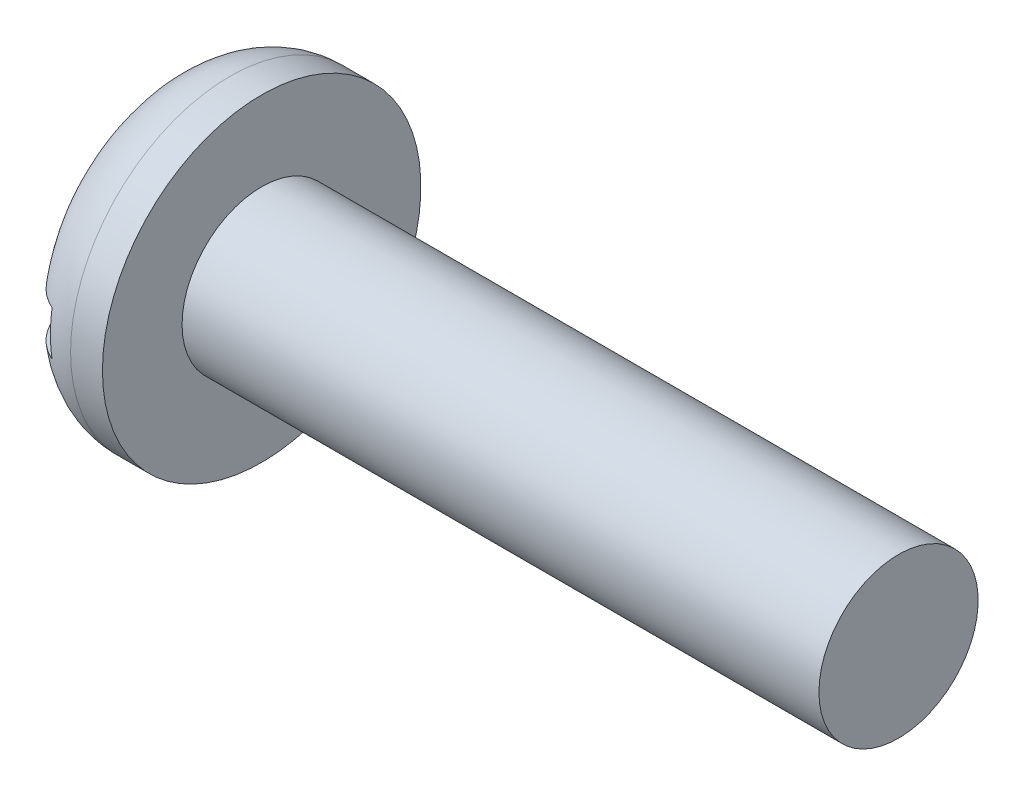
SolidWorks part; units mm, degrees
ref_plane "Plane1" through (0, 0, 0) normal (0, 0, 1) x (1, 0, 0)
ref_plane "Plane2" through (0, 0, 0) normal (0, 1, 0) x (1, 0, 0)
ref_plane "Plane3" through (0, 0, 0) normal (1, 0, 0) x (0, 0, -1)
other "Configuration Table"
sketch "BodySke" plane through (0, 0, 0) normal (0, 0, 1) x (1, 0, 0)
  line L0 (6, 5) -> (6, 10)
  line L1 (0, 0) -> (0, 6)
  line L2 (-25.4, 0) -> (127, 0) construction
  line L3 (46, 0) -> (0, 0)
  line L4 (6, 5) -> (46, 5)
  line L5 (46, 5) -> (46, 0)
  line L6 (4, 10) -> (6, 10)
  line L7 (6, -5) -> (46, -5) construction
  line L8 (0, -10) -> (6, -10) construction
  line L9 (7.5, 6.5875) -> (7.5, -2.9375) construction
  line L10 (6, 6.35) -> (6, -3.175) construction
  arc A0 (0, 6) -> (4, 10) centre (4, 6) cw
  point P15 (0, 10)
revolve "Base-Revolve" add sketch "BodySke" angle 360 about L2
sketch "Sketch2" plane through (0, 0, 0) normal (1, 0, 0) x (0, 0, -1)
  line L0 (10, -1.4) -> (-10, -1.4)
  line L1 (10, -1.4) -> (10, 1.4)
  line L2 (-10, 1.4) -> (10, 1.4)
  line L3 (-10, 1.4) -> (-10, -1.4)
extrude "Slot" cut sketch "Sketch2" along normal blind 2.4
sketch "ThdSchSke" plane through (0, 0, 0) normal (0, 0, 1) x (1, 0, 0)
  line L0 (7.5, -4.172) -> (6.9202, -5)
  line L1 (7.5, -4.172) -> (8.0798, -5)
  line L2 (8.0798, -5) -> (8.0798, -6.25)
  line L3 (-3.175, 0) -> (5.1513, 0) construction
  line L5 (8.0798, -6.25) -> (6.9202, -6.25)
  line L6 (6.9202, -6.25) -> (6.9202, -5)
revolve "ThreadSchematic" [suppressed] cut sketch "ThdSchSke" angle 360 about L3
pattern_linear "ThdSchPat" [suppressed]
equation "\"D1@Sketch2\" = \"Head_dia@BodySke\""
equation "\"D2@Sketch2\" = \"D1@Sketch2\" / 2"
equation "\"D3@Sketch2\" = \"Slot_width@Sketch2\" / 2"
equation "\"Thread_length@ThreadCosmetic\" = ((sgn( (\"Length@BodySke\" - \"Advance@BodySke\" ) - \"Thread_nom@BodySke\" )-1)*( (\"Length@BodySke\" - \"Advance@BodySke\" ) - \"Thread_nom@BodySke\" ))/-2+ \"Thread_nom@BodySke\""
equation "\"Thread_minor@ThdSchSke\" = \"Thread_minor@ThreadCosmetic\""
equation "\"Diameter@ThdSchSke\" = \"Diameter@BodySke\""
equation "\"Overcut@ThdSchSke\" = \"Diameter@BodySke\" * 1.25"
equation "\"Start@ThdSchSke\" = \"Head_ht@BodySke\" + \"Length@BodySke\" - \"Thread_length@ThreadCosmetic\"  '---Non-countersunk---"
equation "\"Num_threads@ThdSchPat\" = int( \"Thread_length@ThreadCosmetic\" / \"Advance@BodySke\" + 0.999 )  + 1"
equation "\"Advance@ThdSchPat\" = \"Thread_length@ThreadCosmetic\" /  (\"Num_threads@ThdSchPat\" - 1) 'relax it"
